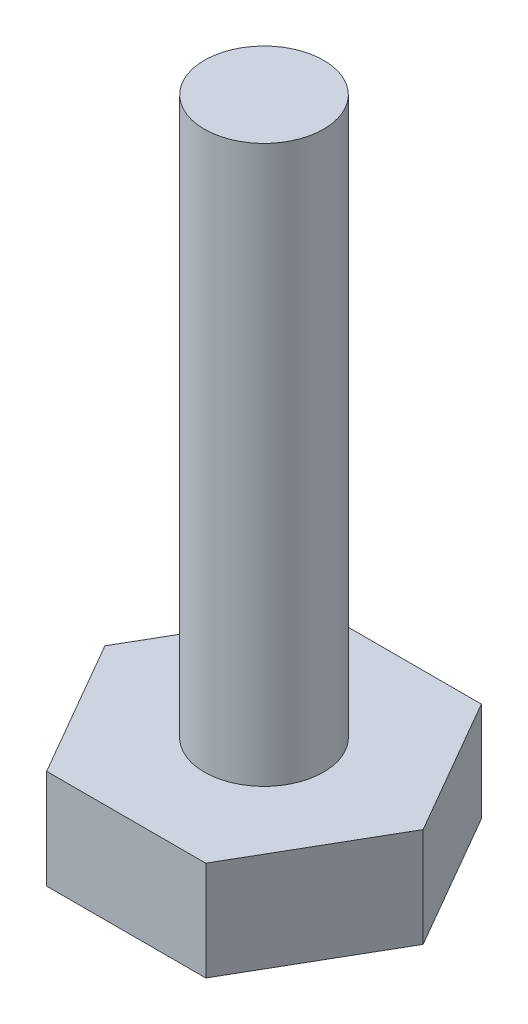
SolidWorks part; units mm, degrees
ref_plane "Front Plane" through (0, 0, 0) normal (0, 0, 1) x (1, 0, 0)
ref_plane "Top Plane" through (0, 0, 0) normal (0, 1, 0) x (1, 0, 0)
ref_plane "Right Plane" through (0, 0, 0) normal (1, 0, 0) x (0, 0, -1)
sketch "Sketch1" plane through (0, 0, 0) normal (0, 1, 0) x (1, 0, 0)
  line L1 (20, 0) -> (10, 17.3205)
  line L2 (10, 17.3205) -> (-10, 17.3205)
  line L3 (-10, 17.3205) -> (-20, 0)
  line L4 (-20, 0) -> (-10, -17.3205)
  line L5 (-10, -17.3205) -> (10, -17.3205)
  line L6 (10, -17.3205) -> (20, 0)
  circle A0 centre (0, 0) radius 17.3205 construction
  dimension "D1" = 20
extrude "Boss-Extrude1" add sketch "Sketch1" along normal blind 12.5
sketch "Sketch2" plane through (0, 12.5, 0) normal (0, 1, 0) x (1, 0, 0)
  circle A0 centre (0, 0) radius 7.5
  dimension "D1" = 15
extrude "Boss-Extrude2" add sketch "Sketch2" along normal blind 70
